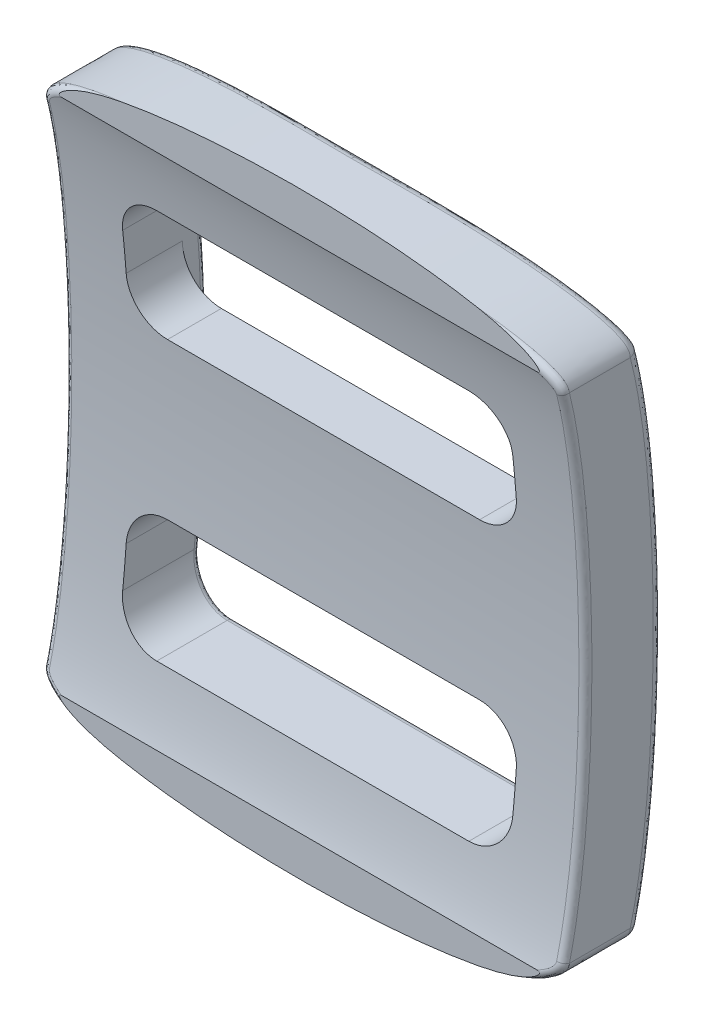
SolidWorks part; units mm, degrees
ref_plane "Ebene vorne" through (0, 0, 0) normal (0, 0, 1) x (1, 0, 0)
ref_plane "Ebene oben" through (0, 0, 0) normal (0, 1, 0) x (1, 0, 0)
ref_plane "Ebene rechts" through (0, 0, 0) normal (1, 0, 0) x (0, 0, -1)
sketch "Skizze1" plane through (0, 0, 0) normal (0, 0, 1) x (1, 0, 0)
  line L1 (-1.5, 0) -> (-13.5, 0)
  line L2 (0, 1.5) -> (0, 3)
  line L3 (-1.5, 4.5) -> (-13.5, 4.5)
  line L4 (-15, 1.5) -> (-15, 3)
  line L5 (-13.5, -6) -> (-1.5, -6)
  line L6 (-15, -7.5) -> (-15, -9)
  line L7 (-13.5, -10.5) -> (-1.5, -10.5)
  line L8 (0, -7.5) -> (0, -9)
  line L9 (-17.5, 8.5) -> (2.5, 8.5)
  line L10 (-17.5, 8.5) -> (-17.5, -14.5)
  line L11 (-17.5, -14.5) -> (2.5, -14.5)
  line L12 (2.5, 8.5) -> (2.5, -14.5)
  arc A0 (-1.5, -10.5) -> (0, -9) centre (-1.5, -9) ccw
  arc A1 (-1.5, -6) -> (0, -7.5) centre (-1.5, -7.5) cw
  arc A2 (-15, -9) -> (-13.5, -10.5) centre (-13.5, -9) ccw
  arc A3 (-13.5, -6) -> (-15, -7.5) centre (-13.5, -7.5) ccw
  arc A4 (-1.5, 0) -> (0, 1.5) centre (-1.5, 1.5) ccw
  arc A5 (0, 3) -> (-1.5, 4.5) centre (-1.5, 3) ccw
  arc A6 (-13.5, 4.5) -> (-15, 3) centre (-13.5, 3) ccw
  arc A7 (-13.5, 0) -> (-15, 1.5) centre (-13.5, 1.5) cw
  ellipse E0 centre (-7.5, 6.5) end of major axis (-17.5, 6.5) minor radius 2 (-7.5, 8.5) -> (-17.5, 6.5) ccw
  ellipse E1 centre (-7.5, 6.5) end of major axis (2.5, 6.5) minor radius 2 (-7.5, 8.5) -> (2.5, 6.5) cw
  ellipse E2 centre (-7.5, -12.5) end of major axis (-17.5, -12.5) minor radius 2 (-7.5, -14.5) -> (-17.5, -12.5) cw
  ellipse E3 centre (-7.5, -12.5) end of major axis (2.5, -12.5) minor radius 2 (-7.5, -14.5) -> (2.5, -12.5) ccw
  point P11 (0, -10.5)
  point P14 (0, -6)
  point P17 (-15, -10.5)
  point P22 (0, 0)
  point P25 (0, 4.5)
  point P28 (-15, 4.5)
  point P35 (-17.5, 6.5)
  point P36 (2.5, 6.5)
  point P37 (-7.5, 8.5)
  point P38 (-7.5, -14.5)
  point P39 (-17.5, -12.5)
  point P40 (2.5, -12.5)
  dimension "D6" = 1.5
  dimension "D1" = 4.5
  dimension "D2" = 4.5
  dimension "D3" = 15
  dimension "D4" = 15
  dimension "D5" = 6
  dimension "D7" = 4
  dimension "D8" = 4
  dimension "D9" = 2.5
  dimension "D10" = 2.5
  dimension "D11" = 2
  dimension "D12" = 2
  dimension "D13" = 2
  dimension "D14" = 2
extrude "Aufsatz-Linear austragen1" add sketch "Skizze1" along normal blind 5 contours E2 E3 L12 E1 E0 L10 A3 L5 A1 L8 A0 L7 A2 L6 L1 A7 L4 A6 L3 A5 L2 A4
sketch "Skizze3" plane through (0, 0, 0) normal (1, 0, 0) x (0, 0, -1)
  line L0 (-2, 8.5) -> (0, 8.5)
  line L1 (-2, -14.5) -> (0, -14.5)
  line L2 (0, 8.5) -> (0, -14.5)
  line L4 (-5, 8.5) -> (-5, -14.5)
  ellipse E0 centre (-2, -3) end of major axis (-2, 8.5) minor radius 2 (0, -3) -> (-2, 8.5) ccw
  ellipse E1 centre (-2, -3) end of major axis (-2, -14.5) minor radius 2 (0, -3) -> (-2, -14.5) cw
  ellipse E2 centre (-5, -3) end of major axis (-5, 8.5) minor radius 2 (-3, -3) -> (-5, -14.5) cw
  ellipse E3 centre (-5, -3) end of major axis (-5, 8.5) minor radius 2 (-3, -3) -> (-5, 8.5) ccw
  point P5 (-2, 8.5)
  point P6 (-2, -14.5)
  point P7 (0, -3)
  point P9 (-3, -3)
  dimension "D1" = 23
  dimension "D3" = 0
  dimension "D4" = 5
  dimension "D5" = 2
  dimension "D6" = 2
  dimension "D7" = 2
sketch "Skizze4" plane through (0, 0, 0) normal (0, 0, 1) x (1, 0, 0)
  line L0 (-15, -7.5) -> (-15, -9) construction
  line L1 (-15, -8.25) -> (0, -8.25)
  line L2 (-15, -8.25) -> (-15, 2.25)
  line L3 (-15, 2.25) -> (0, 2.25)
  line L4 (0, -8.25) -> (0, 2.25)
  line L5 (0, 1.5) -> (0, 3) construction
extrude "Schnitt-Linear austragen5" cut sketch "Skizze4" along normal blind 1
extrude "Schnitt-Linear austragen6" cut sketch "Skizze3" against normal through all both and the other way through all contours E0 L2 L0 | L2 E1 L1 | E2 E3 L4
sketch "Skizze5" plane through (0, 0, 0) normal (0, 1, 0) x (1, 0, 0)
  line L1 (-17.5, -4) -> (2.5, -4)
  line L2 (-17.5, -4) -> (-17.5, -6)
  line L3 (-17.5, -6) -> (2.5, -6)
  line L4 (2.5, -4) -> (2.5, -6)
  dimension "D1" = 2.5
  dimension "D2" = 20
  dimension "D3" = 4
  dimension "D4" = 2
extrude "Schnitt-Linear austragen7" cut sketch "Skizze5" against normal through all both and the other way through all
fillet "Verrundung1" radius 0.25 14 edges at (-14.6675, 3.9418, 0.4055) (-7.5, 4.5, 0.4839) (-0.5701, 4.1769, 0.4373) (0, -3, 0) (-0.5701, -10.1769, 0.4373) (-7.5, -10.5, 0.4839) (-14.6675, -9.9418, 0.4055) (-17.4715, 6.6508, 3.9124) (-17.4715, -12.6508, 3.9124) (2.4715, 6.6508, 3.9124) (2.4715, -12.6508, 3.9124) (-15, -3, 0) (-17.5, -3, 3) (2.5, -3, 3)
fillet "Verrundung2" radius 0.39 6 edges at (-17.5, -3, 0) (-15.978, -13.5606, 1.2083) (-15.978, 7.5606, 1.2083) (0.978, -13.5606, 1.2083) (0.978, 7.5606, 1.2083) (2.5, -3, 0)
